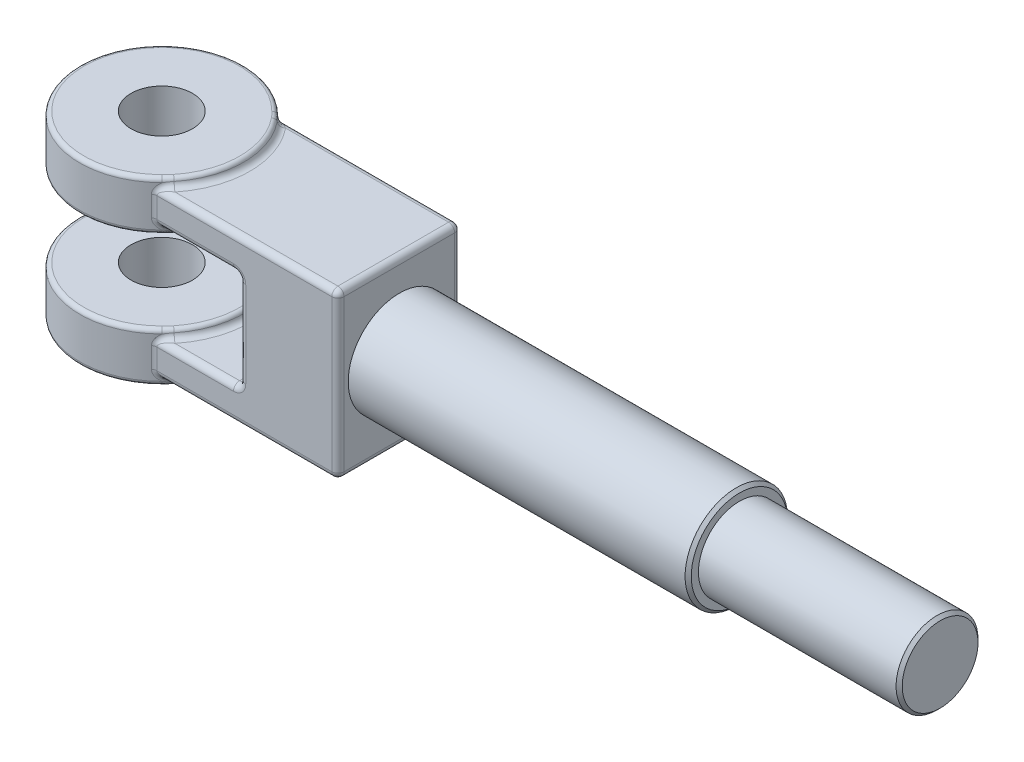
SolidWorks part; units mm, degrees
ref_plane "Plane1" through (0, 0, 0) normal (0, 0, 1) x (1, 0, 0)
ref_plane "Plane2" through (0, 0, 0) normal (0, 1, 0) x (1, 0, 0)
ref_plane "Plane3" through (0, 0, 0) normal (1, 0, 0) x (0, 0, -1)
sketch "Esquisse1" plane through (0, 0, 0) normal (0, 0, 1) x (1, 0, 0)
  line L0 (-98, 40) -> (-3, 40)
  line L1 (-98, 40) -> (-98, 24)
  line L2 (-3, -40) -> (-98, -40)
  line L3 (0, -37) -> (0, 37)
  line L4 (-98, 24) -> (-51, 24)
  line L5 (-48, 21) -> (-48, -21)
  line L6 (-51, -24) -> (-98, -24)
  line L7 (-98, -24) -> (-98, -40)
  arc A0 (0, 37) -> (-3, 40) centre (-3, 37) ccw
  arc A1 (0, -37) -> (-3, -40) centre (-3, -37) cw
  arc A2 (-48, 21) -> (-51, 24) centre (-51, 21) ccw
  arc A3 (-48, -21) -> (-51, -24) centre (-51, -21) cw
  point P11 (0, 40)
  point P14 (0, -40)
  point P17 (-48, 24)
  point P20 (-48, -24)
  dimension "D6" = 3
  dimension "D1" = 48
  dimension "D2" = 80
  dimension "D3" = 48
  dimension "D4" = 50
  dimension "D5" = 16
  dimension "D7" = 24
  dimension "D8" = 48
extrude "Base-Extrusion" add sketch "Esquisse1" along normal mid plane 60
sketch "Esquisse3" plane through (0, 0, 0) normal (1, 0, 0) x (0, 0, -1)
  circle A0 centre (0, 0) radius 25
  dimension "D1" = 50
extrude "Boss.-Extru.1" add sketch "Esquisse3" along normal blind 166
sketch "Esquisse4" plane through (166, 0, 0) normal (1, 0, 0) x (0, 0, -1)
  circle A0 centre (0, 0) radius 20
  dimension "D1" = 40
extrude "Boss.-Extru.2" add sketch "Esquisse4" along normal blind 98
sketch "Esquisse5" plane through (0, 0, 0) normal (0, 1, 0) x (1, 0, 0)
  line L0 (166, 0) -> (0, 0) construction
  circle A0 centre (-116, 0) radius 40
  dimension "D1" = 80
  dimension "D2" = 116
extrude "Boss.-Extru.3" add sketch "Esquisse5" along normal mid plane 88
sketch "Esquisse6" plane through (0, 44, 0) normal (0, 1, 0) x (-1, 0, 0)
  circle A0 centre (116, 0) radius 15
  circle A1 centre (116, 0) radius 40 construction
  dimension "D1" = 30
extrude "Enlèv. mat.-Extru.1" cut sketch "Esquisse6" against normal through all
sketch "Esquisse8" plane through (0, 0, 0) normal (0, 0, 1) x (1, 0, 0)
  line L0 (-163.2753, 0) -> (-68.0591, 0)
  line L1 (166, 0) -> (0, 0) construction
extrude "Enlèv. de mat.-Extru.-Mince1" cut sketch "Esquisse8" against normal through all thin
sketch "Esquisse9" plane through (0, 0, 0) normal (0, 1, 0) x (1, 0, 0)
  line L0 (166, 0) -> (0, 0) construction
  circle A0 centre (-116, 0) radius 40
  dimension "D2" = 80
  dimension "D1" = 116
extrude "Boss.-Extru.4" add sketch "Esquisse9" along normal mid plane 88
sketch "Esquisse10" plane through (0, 0, 0) normal (0, 0, 1) x (1, 0, 0)
  line L0 (-166.3141, 0) -> (-64.0073, 0)
extrude "Enlèv. de mat.-Extru.-Mince2" cut sketch "Esquisse10" against normal mid plane 88 thin
fillet "Congé2" radius 3
fillet "Congé3" radius 2
chamfer "Chanfrein1" distance 1.5 angle 45
sketch "Esquisse11" plane through (0, -44, 0) normal (0, -1, 0) x (1, 0, 0)
  circle A0 centre (-116, 0) radius 15
  dimension "D1" = 30
extrude "Enlèv. mat.-Extru.2" cut sketch "Esquisse11" against normal through all
